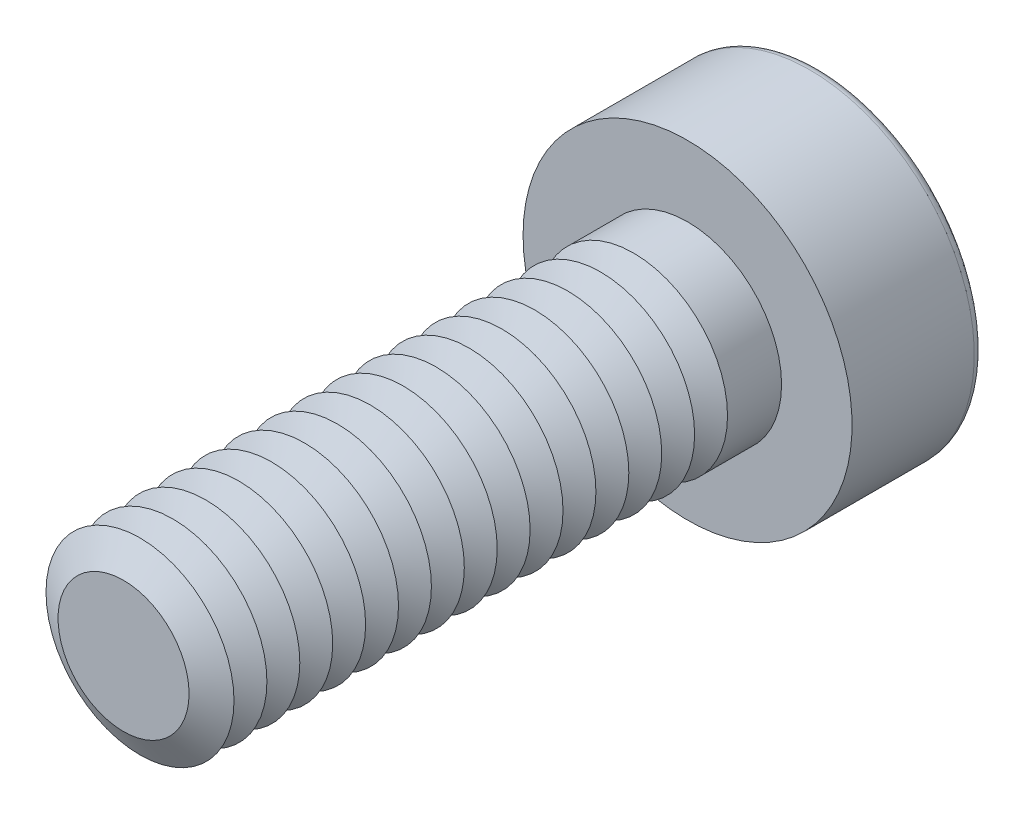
SolidWorks part; units mm, degrees
ref_plane "Front Plane" through (0, 0, 0) normal (0, 0, 1) x (1, 0, 0)
ref_plane "Top Plane" through (0, 0, 0) normal (0, 1, 0) x (1, 0, 0)
ref_plane "Right Plane" through (0, 0, 0) normal (1, 0, 0) x (0, 0, -1)
sketch "Sketch1" plane through (0, 0, 0) normal (0, 0, 1) x (1, 0, 0)
  circle A0 centre (0, 0) radius 2
  dimension "D1" = 4
extrude "Boss-Extrude1" add sketch "Sketch1" along normal blind 12
sketch "Sketch2" plane through (0, 0, 0) normal (0, 0, -1) x (-1, 0, 0)
  circle A0 centre (0, 0) radius 3.5
  dimension "D1" = 7
extrude "Boss-Extrude2" add sketch "Sketch2" along normal blind 2.8
sketch "Sketch3" plane through (0, 0, -2.8) normal (0, 0, -1) x (-1, 0, 0)
  line L1 (-0.7217, 1.25) -> (-1.4434, 0)
  line L2 (-1.4434, 0) -> (-0.7217, -1.25)
  line L3 (-0.7217, -1.25) -> (0.7217, -1.25)
  line L4 (0.7217, -1.25) -> (1.4434, 0)
  line L5 (1.4434, 0) -> (0.7217, 1.25)
  line L6 (0.7217, 1.25) -> (-0.7217, 1.25)
  circle A0 centre (0, 0) radius 1.25 construction
  dimension "D1" = 2.5
extrude "Cut-Extrude1" cut sketch "Sketch3" against normal blind 1.875
fillet "Fillet1" radius 0.2 1 edges at (-3.5, 0, -2.8)
sketch "Sketch4" plane through (0, 0, -0.925) normal (0, 0, -1) x (-1, 0, 0)
  line L0 (0.7217, -1.25) -> (1.4434, 0) construction
  circle A0 centre (0, 0) radius 1.25
extrude "Cut-Extrude2" cut sketch "Sketch4" against normal through all draft 60
sketch "Sketch5" plane through (0, 0, -2.8) normal (0, 0, -1) x (-1, 0, 0)
  circle A0 centre (0, 0) radius 1.4434
extrude "Cut-Extrude3" cut sketch "Sketch5" against normal through all draft 75
sketch "Sketch7" plane through (0, 0, 0) normal (1, 0, 0) x (0, 0, -1)
  line L25 (-12, 1.3938) -> (-11.65, 2)
  line L26 (-12, 2) -> (-12, -2) construction
  line L27 (-11.65, 2) -> (-12.35, 2)
  line L28 (-12.35, 2) -> (-12, 1.3938)
  line L29 (0, 2) -> (-12, 2) construction
  dimension "D1" = 0.7
revolve "Cut-Revolve1" cut sketch "Sketch7" angle 360 about axis through (0, 0, 12) along (0, 0, -1)
pattern_linear "LPattern1" count 16 spacing 0.7 along (0, 0, -1) of "Cut-Revolve1"
